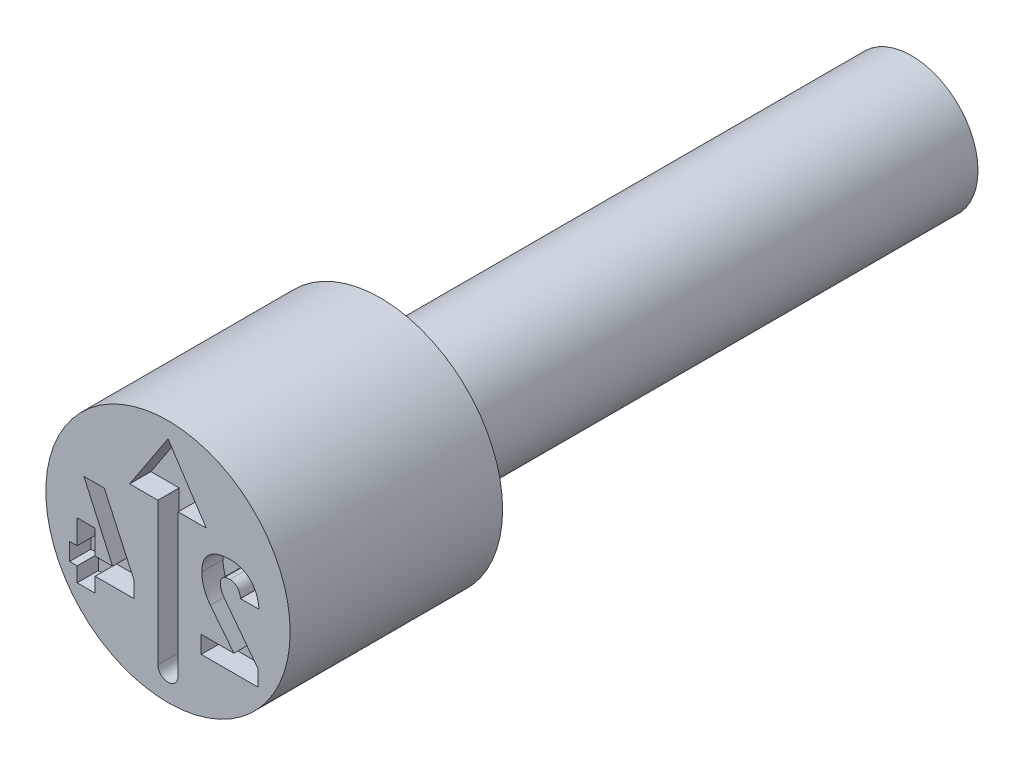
SolidWorks part; units mm, degrees
ref_plane "Front Plane" through (0, 0, 0) normal (0, 0, 1) x (1, 0, 0)
ref_plane "Top Plane" through (0, 0, 0) normal (0, 1, 0) x (1, 0, 0)
ref_plane "Right Plane" through (0, 0, 0) normal (1, 0, 0) x (0, 0, -1)
sketch "Sketch2" plane through (0, 0, 0) normal (1, 0, 0) x (0, 0, -1)
  line L0 (0.4039, 0) -> (50000.4039, 0) construction
  line L6 (0, 2.3) -> (0, 0)
  line L7 (4, 2.3) -> (0, 2.3)
  line L8 (4, 1.25) -> (4, 2.3)
  line L9 (14, 1.25) -> (4, 1.25)
  line L10 (14, 0) -> (14, 1.25)
  line L11 (0, 0) -> (14, 0)
  dimension "D1" = 4.6
  dimension "D2" = 2.5
  dimension "D3" = 14
  dimension "D4" = 4
revolve "Revolve1" add sketch "Sketch2" angle 360 about L0
sketch "Sketch3" plane through (0, 0, 0) normal (0, 0, 1) x (1, 0, 0)
  line L0 (0, 0) -> (0, 100000) construction
  line L1 (0.1905, 0.9064) -> (0.1905, -1.7762)
  line L2 (0.7219, 0.9064) -> (0.1905, 0.9064)
  line L3 (0, 2.0021) -> (0.7219, 0.9064)
  line L15 (0, 2.0021) -> (-0.7219, 0.9064)
  line L16 (-0.7219, 0.9064) -> (-0.1905, 0.9064)
  line L17 (-0.1905, 0.9064) -> (-0.1905, -1.7762)
  arc A2 (-0.1905, -1.7762) -> (0.1905, -1.7762) centre (0, -1.7762) ccw
extrude "Cut-Extrude4" cut sketch "Sketch3" against normal blind 0.4
sketch "Sketch4" plane through (0, 0, 0) normal (0, 0, 1) x (1, 0, 0)
  text T0 "2  4" font "Bahnschrift" height 1.8
  dimension "D1" = 1.2
extrude "Cut-Extrude5" cut sketch "Sketch4" against normal blind 0.4
